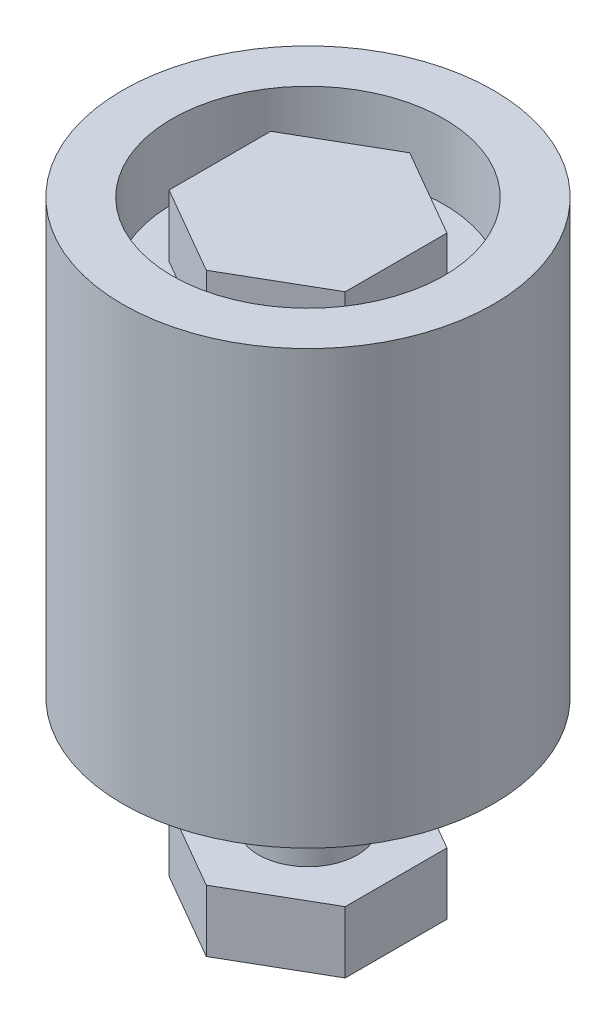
SolidWorks part; units mm, degrees
ref_plane "Front Plane" through (0, 0, 0) normal (0, 0, 1) x (1, 0, 0)
ref_plane "Top Plane" through (0, 0, 0) normal (0, 1, 0) x (1, 0, 0)
ref_plane "Right Plane" through (0, 0, 0) normal (1, 0, 0) x (0, 0, -1)
sketch "Sketch1" plane through (0, 0, 0) normal (0, 1, 0) x (1, 0, 0)
  circle A0 centre (0, 0) radius 4
  circle A1 centre (0, 0) radius 6
  dimension "D1" = 8
  dimension "D2" = 2
extrude "Boss-Extrude1" add sketch "Sketch1" along normal blind 3
sketch "Sketch2" plane through (0, 3, 0) normal (0, 1, 0) x (1, 0, 0)
  circle A0 centre (0, 0) radius 15
  circle A1 centre (0, 0) radius 4 construction
  circle A2 centre (0, 0) radius 4
  dimension "D1" = 30
extrude "Boss-Extrude2" add sketch "Sketch2" along normal blind 35
sketch "Sketch3" plane through (0, 38, 0) normal (0, 1, 0) x (1, 0, 0)
  circle A0 centre (0, 0) radius 11
  dimension "D1" = 22
extrude "Cut-Extrude1" cut sketch "Sketch3" against normal blind 6 contours A0
sketch "Sketch4" plane through (0, 32, 0) normal (0, 1, 0) x (1, 0, 0)
  line L1 (0, -8.229) -> (7.1266, -4.1145)
  line L2 (7.1266, -4.1145) -> (7.1266, 4.1145)
  line L3 (7.1266, 4.1145) -> (0, 8.229)
  line L4 (0, 8.229) -> (-7.1266, 4.1145)
  line L5 (-7.1266, 4.1145) -> (-7.1266, -4.1145)
  line L6 (-7.1266, -4.1145) -> (0, -8.229)
  circle A0 centre (0, 0) radius 4
  circle A1 centre (0, 0) radius 11
  circle A2 centre (0, 0) radius 11
  circle A4 centre (0, 0) radius 7.1266 construction
  dimension "D1" = 0
extrude "Boss-Extrude4" add sketch "Sketch4" against normal blind 43.08 contours M3
sketch "Sketch5" plane through (0, 32, 0) normal (0, 1, 0) x (1, 0, 0)
  line L6 (0, -8.229) -> (7.1266, -4.1145)
  line L7 (7.1266, -4.1145) -> (7.1266, 4.1145)
  line L8 (7.1266, 4.1145) -> (0, 8.229)
  line L9 (0, 8.229) -> (-7.1266, 4.1145)
  line L10 (-7.1266, 4.1145) -> (-7.1266, -4.1145)
  line L11 (-7.1266, -4.1145) -> (0, -8.229)
  line L12 (0, -8.229) -> (7.1266, -4.1145)
  line L13 (7.1266, -4.1145) -> (7.1266, 4.1145)
  line L14 (7.1266, 4.1145) -> (0, 8.229)
  line L15 (0, 8.229) -> (-7.1266, 4.1145)
  line L16 (-7.1266, 4.1145) -> (-7.1266, -4.1145)
  line L17 (-7.1266, -4.1145) -> (0, -8.229)
  circle A1 centre (0, 0) radius 11
  circle A2 centre (0, 0) radius 11
  circle A3 centre (0, 0) radius 4
  circle A4 centre (0, 0) radius 4
  dimension "D1" = 0
  dimension "D2" = 0
  dimension "D3" = 0
extrude "Boss-Extrude5" add sketch "Sketch5" along normal blind 5 contours L16 L17 L12 L13 L14 L15 A4 | A4
sketch "Sketch6" plane through (0, -11.08, 0) normal (0, -1, 0) x (1, 0, 0)
  line L6 (7.1266, 4.1145) -> (0, 8.229)
  line L7 (7.1266, -4.1145) -> (7.1266, 4.1145)
  line L8 (0, -8.229) -> (7.1266, -4.1145)
  line L9 (-7.1266, -4.1145) -> (0, -8.229)
  line L10 (-7.1266, 4.1145) -> (-7.1266, -4.1145)
  line L11 (0, 8.229) -> (-7.1266, 4.1145)
  line L12 (7.1266, 4.1145) -> (0, 8.229)
  line L13 (7.1266, -4.1145) -> (7.1266, 4.1145)
  line L14 (0, -8.229) -> (7.1266, -4.1145)
  line L15 (-7.1266, -4.1145) -> (0, -8.229)
  line L16 (-7.1266, 4.1145) -> (-7.1266, -4.1145)
  line L17 (0, 8.229) -> (-7.1266, 4.1145)
  dimension "D3" = 0
extrude "Boss-Extrude6" add sketch "Sketch6" against normal blind 5
